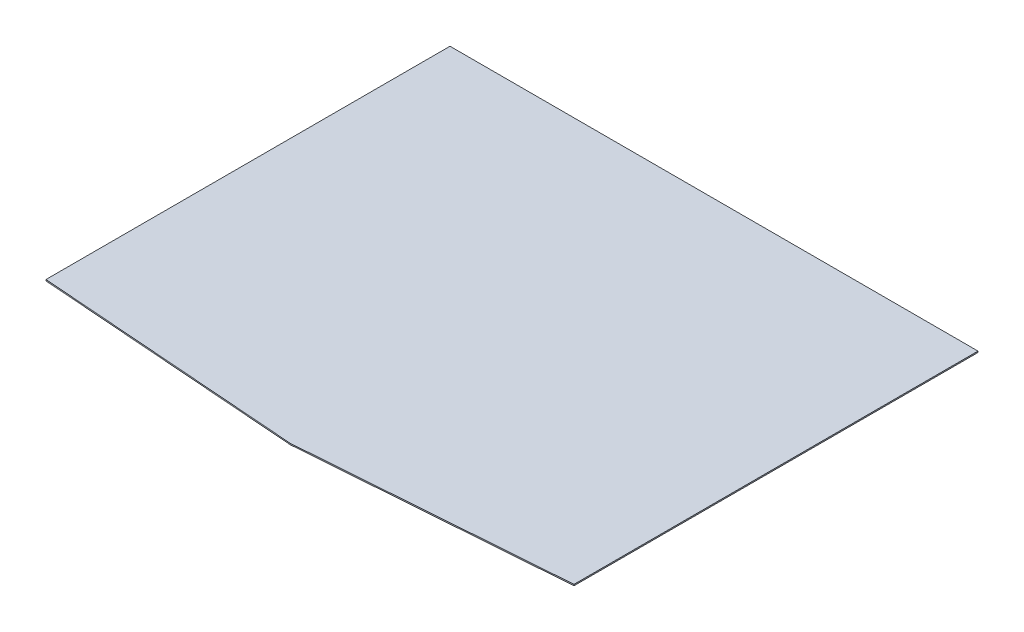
SolidWorks part; units mm, degrees
ref_plane "FRONT" through (0, 0, 0) normal (0, 0, 1) x (1, 0, 0)
ref_plane "TOP" through (0, 0, 0) normal (0, 1, 0) x (1, 0, 0)
ref_plane "RIGHT" through (0, 0, 0) normal (1, 0, 0) x (0, 0, -1)
sketch "Sketch1" plane through (0, 0, 0) normal (0, 1, 0) x (1, 0, 0)
  line L0 (0, 0) -> (-996.95, 74.6125)
  line L1 (-1154.3121, 0) -> (862.7505, 0) construction
  line L2 (0, 0) -> (996.95, 74.6125)
  line L3 (996.95, 74.6125) -> (996.95, 1600.2)
  line L4 (996.95, 1600.2) -> (-996.95, 1600.2)
  line L5 (-996.95, 1600.2) -> (-996.95, 74.6125)
  line L6 (0, 0) -> (0, 1437.6671) construction
  dimension "D4" = 74.6125
  dimension "D5" = 1525.5875
  dimension "D6" = 1600.2
  dimension "D7" = 1993.9
sheet metal parameters "Sheet-Metal1" thickness 4.7625 parameters "D1"=4.7625
base flange "Base-Flange1" sketch "Sketch1" thickness 4.7625 reverse thickness direction no parameters "D1"=4.7625
flat pattern "Flat-Pattern1"
sketch "Bend-Lines1" plane through (0, 0, 0) normal (0, 1, 0) x (-1, 0, 0)
sketch3d "Bounding-Box1" [suppressed]
  line L0 (0, 74.6125, 0) -> (-1993.9, 74.6125, 0) construction
  line L1 (0, -1525.5875, 0) -> (-1993.9, -1525.5875, 0) construction
  line L2 (0, 74.6125, 0) -> (0, -1525.5875, 0) construction
  line L3 (-1993.9, 74.6125, 0) -> (-1993.9, -1525.5875, 0) construction
